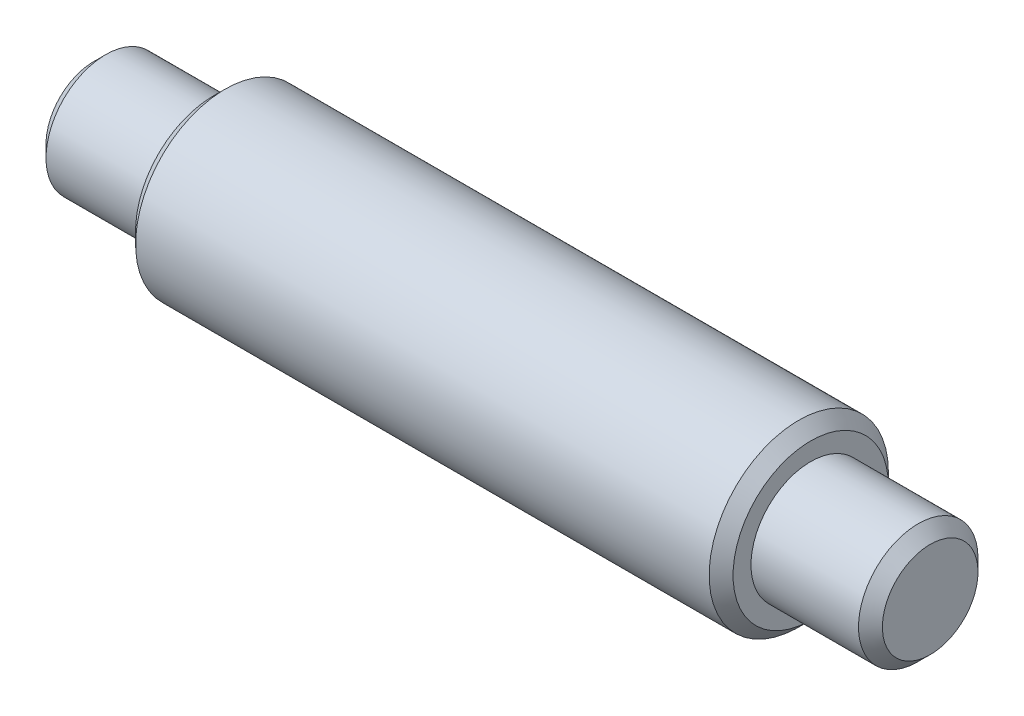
SolidWorks part; units mm, degrees
ref_plane "Front Plane" through (0, 0, 0) normal (0, 0, 1) x (1, 0, 0)
ref_plane "Top Plane" through (0, 0, 0) normal (0, 1, 0) x (1, 0, 0)
ref_plane "Right Plane" through (0, 0, 0) normal (1, 0, 0) x (0, 0, -1)
sketch "Sketch2" plane through (0, 0, 0) normal (1, 0, 0) x (0, 0, -1)
  circle A0 centre (0, 0) radius 7.5
  dimension "D1" = 15
extrude "Boss-Extrude1" add sketch "Sketch2" along normal mid plane 50
chamfer "Chamfer1" distance 1 angle 45 2 edges at (25, 0, -7.5) (-25, 0, -7.5)
sketch "Sketch3" plane through (25, 0, 0) normal (1, 0, 0) x (0, 0, -1)
  circle A0 centre (0, 0) radius 5
  dimension "D1" = 10
extrude "Boss-Extrude2" add sketch "Sketch3" along normal blind 10
chamfer "Chamfer2" distance 1 angle 45 1 edges at (35, 0, -5)
mirror "Mirror2" about plane through (0, 0, 0) normal (1, 0, 0) of "Boss-Extrude2", "Chamfer2"
